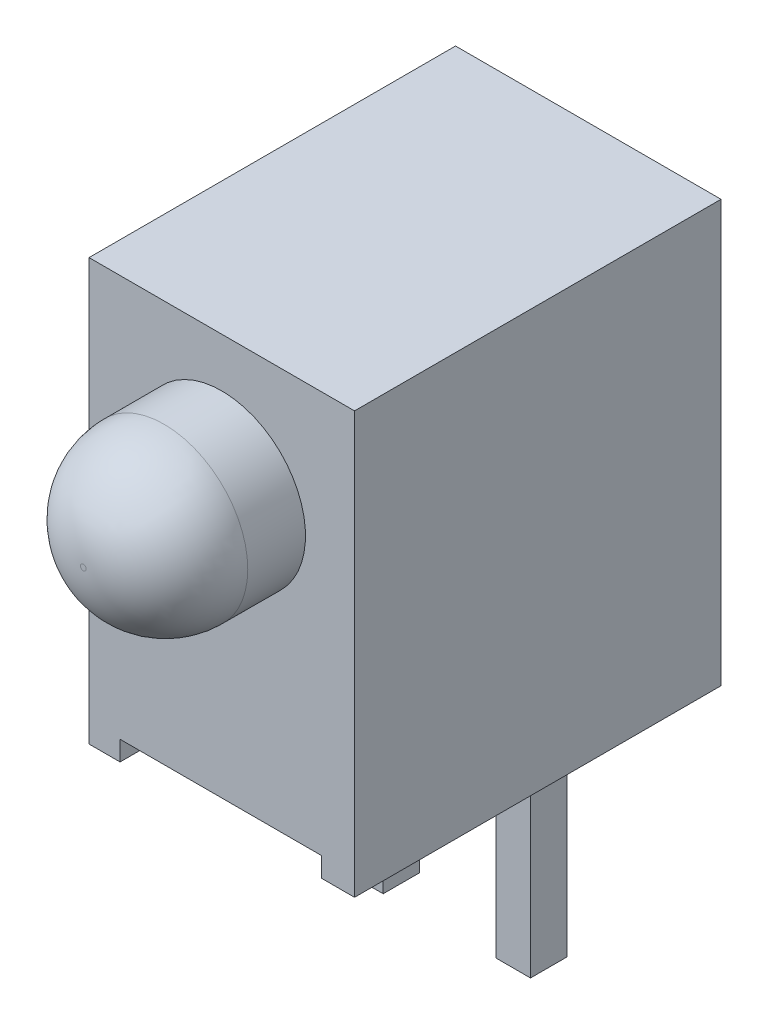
SolidWorks part; units mm, degrees
ref_plane "Front Plane" through (0, 0, 0) normal (0, 0, 1) x (1, 0, 0)
ref_plane "Top Plane" through (0, 0, 0) normal (0, 1, 0) x (1, 0, 0)
ref_plane "Right Plane" through (0, 0, 0) normal (1, 0, 0) x (0, 0, -1)
sketch "Sketch1" plane through (0, 0, 0) normal (0, 1, 0) x (1, 0, 0)
  line L1 (-2.3, 3.175) -> (2.3, 3.175)
  line L2 (-2.3, 3.175) -> (-2.3, -3.175)
  line L3 (-2.3, -3.175) -> (2.3, -3.175)
  line L4 (2.3, 3.175) -> (2.3, -3.175)
  line L5 (-2.3, 3.175) -> (2.3, -3.175) construction
  line L6 (-2.3, -3.175) -> (2.3, 3.175) construction
  point P0 (0, 0)
  dimension "D1" = 4.6
  dimension "D2" = 6.35
extrude "Boss-Extrude1" add sketch "Sketch1" along normal blind 7.3
sketch "Sketch2" plane through (0, 0, 3.175) normal (0, 0, 1) x (1, 0, 0)
  line L0 (-2.3, 0) -> (2.3, 0) construction
  circle A0 centre (0, 5) radius 1.45
  dimension "D2" = 2.9
  dimension "D3" = 5
extrude "Boss-Extrude2" add sketch "Sketch2" along normal blind 2.4
fillet "Fillet2" radius 1.4 1 edges at (1.45, 5, 5.575)
sketch "Sketch4" plane through (0, 0, 3.175) normal (0, 0, 1) x (1, 0, 0)
  line L0 (-2.3, 0) -> (2.3, 0) construction
  line L1 (-1.7627, 0) -> (1.7312, 0)
  line L2 (-1.7627, 0) -> (-1.7627, 0.3407)
  line L3 (-1.7627, 0.3407) -> (1.7312, 0.3407)
  line L4 (1.7312, 0) -> (1.7312, 0.3407)
extrude "Cut-Extrude1" cut sketch "Sketch4" against normal through all
sketch "Sketch6" plane through (0, 0.3407, 0) normal (0, -1, 0) x (1, 0, 0)
  line L0 (1.7312, 3.175) -> (2.3, 3.175) construction
  line L1 (-1.5746, -0.596) -> (-0.9746, -0.596)
  line L2 (-1.5746, -0.596) -> (-1.5746, -1.2288)
  line L3 (-1.5746, -1.2288) -> (-0.9746, -1.2288)
  line L4 (-0.9746, -0.596) -> (-0.9746, -1.2288)
  line L5 (-1.5746, -0.596) -> (-0.9746, -1.2288) construction
  line L6 (-1.5746, -1.2288) -> (-0.9746, -0.596) construction
  line L7 (0.9654, -0.6086) -> (1.5654, -0.6086)
  line L8 (0.9654, -0.6086) -> (0.9654, -1.2414)
  line L9 (0.9654, -1.2414) -> (1.5654, -1.2414)
  line L10 (1.5654, -0.6086) -> (1.5654, -1.2414)
  line L11 (0.9654, -0.6086) -> (1.5654, -1.2414) construction
  line L12 (0.9654, -1.2414) -> (1.5654, -0.6086) construction
  line L13 (0, 0) -> (-0.0157, -3.175) construction
  line L14 (1.7312, -3.175) -> (-1.7627, -3.175) construction
  point P0 (-1.2746, -0.9124)
  point P5 (1.2654, -0.925)
  dimension "D1" = 4.1
  dimension "D2" = 2.54
  dimension "D3" = 0.6
  dimension "D4" = 0.6
extrude "Boss-Extrude5" add sketch "Sketch6" along normal blind 3.81
